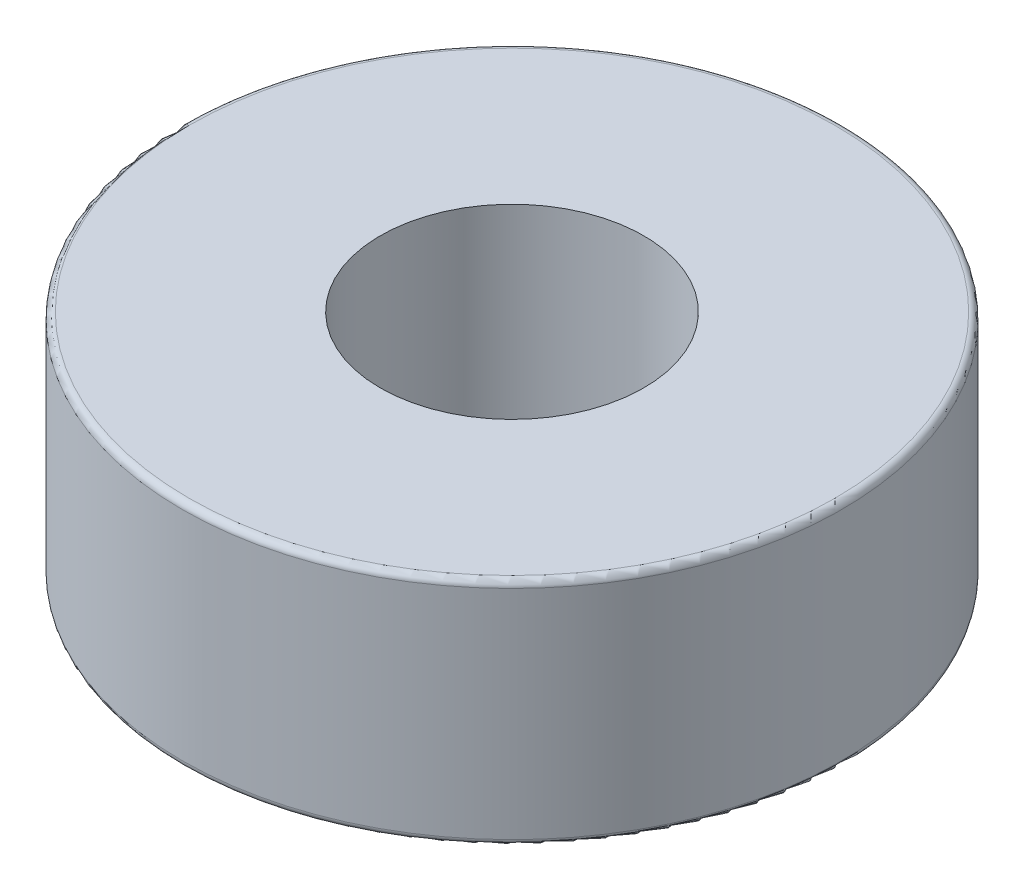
SolidWorks part; units mm, degrees
ref_plane "Front Plane" through (0, 0, 0) normal (0, 0, 1) x (1, 0, 0)
ref_plane "Top Plane" through (0, 0, 0) normal (0, 1, 0) x (1, 0, 0)
ref_plane "Right Plane" through (0, 0, 0) normal (1, 0, 0) x (0, 0, -1)
sketch "Sketch1" plane through (0, 0, 0) normal (0, 1, 0) x (1, 0, 0)
  circle A0 centre (0, 0) radius 10
  circle A1 centre (0, 0) radius 4
  dimension "D1" = 20
  dimension "D2" = 8
extrude "Boss-Extrude1" add sketch "Sketch1" along normal blind 7
fillet "Fillet1" radius 0.2 2 edges at (0, 0, 10) (0, 7, 10)
